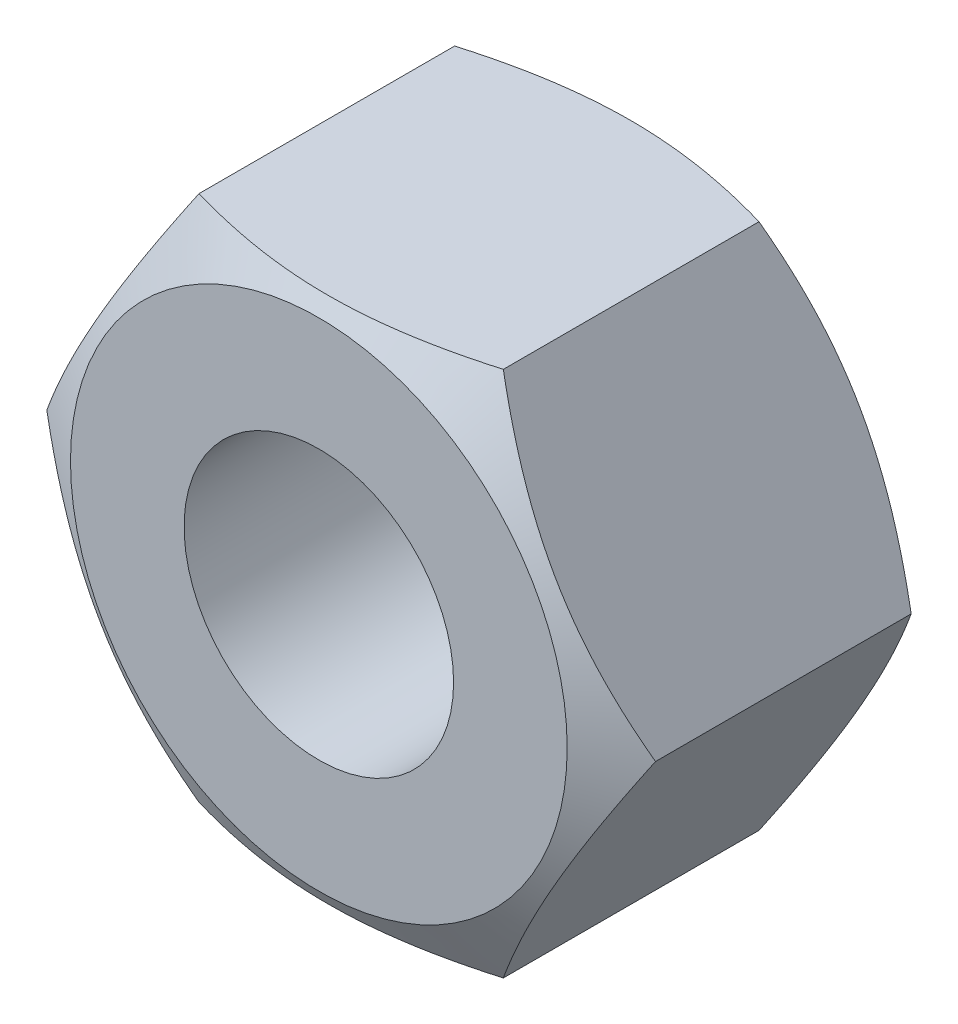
SolidWorks part; units mm, degrees
ref_plane "Front" through (0, 0, 0) normal (0, 0, 1) x (1, 0, 0)
ref_plane "Top" through (0, 0, 0) normal (0, 1, 0) x (1, 0, 0)
ref_plane "Right" through (0, 0, 0) normal (1, 0, 0) x (0, 0, -1)
sketch "Sketch1" plane through (0, 0, 0) normal (0, 0, 1) x (1, 0, 0)
  line L1 (3.7528, -6.5) -> (7.5056, 0)
  line L2 (7.5056, 0) -> (3.7528, 6.5)
  line L3 (3.7528, 6.5) -> (-3.7528, 6.5)
  line L4 (-3.7528, 6.5) -> (-7.5056, 0)
  line L5 (-7.5056, 0) -> (-3.7528, -6.5)
  line L6 (-3.7528, -6.5) -> (3.7528, -6.5)
  circle A0 centre (0, 0) radius 6.5 construction
  circle A1 centre (0, 0) radius 3.3235
  dimension "D" = 6.647
  dimension "s" = 13
extrude "BaseNut" add sketch "Sketch1" against normal blind 7.9
sketch "Sketch2" plane through (0, 0, 0) normal (0, 1, 0) x (1, 0, 0)
  line L0 (-7.5056, 7.9) -> (-6.125, 7.9)
  line L2 (-6.125, 7.9) -> (-7.5056, 7.1029)
  line L3 (-7.5056, 7.1029) -> (-7.5056, 7.9)
  line L4 (0, 3.3759) -> (0, -9.8171) construction
  line L6 (-9.7712, 3.95) -> (9.8853, 3.95) construction
  line L7 (-7.5056, 0.7971) -> (-7.5056, 0)
  line L8 (-6.125, 0) -> (-7.5056, 0.7971)
  line L9 (-7.5056, 0) -> (-6.125, 0)
  line L10 (-7.5056, 7.9) -> (-7.5056, 0) construction
  dimension "D1" = 30
  dimension "dw" = 12.25
  dimension "D2" = 3.95
revolve "Double-Chamfer" cut sketch "Sketch2" angle 360 about L4
sketch "Sketch4" plane through (0, 0, 0) normal (0, 1, 0) x (1, 0, 0)
  line L0 (3.9094, 7.9) -> (3.3235, 7.5617)
  line L1 (3.3235, 7.5617) -> (2.647, 7.5617)
  line L2 (2.647, 7.5617) -> (2.647, 8.2382)
  line L3 (2.647, 8.2382) -> (3.3235, 8.2382)
  line L4 (3.3235, 8.2382) -> (3.9094, 7.9)
  line L5 (0, 0) -> (0, 109.7681) construction
  dimension "D1" = 0.6765
  dimension "D2" = 6.647
revolve "Cut-Revolve10" [suppressed] cut sketch "Sketch4" angle 360 about L5
pattern_linear "LPattern10" [suppressed] count 11 spacing 0.8118 along (0, 0, -1)
equation "\"dw@Sketch2\" = \"s@Sketch1\"-0.75"
equation "\"D2@Sketch2\" = \"m@BaseNut\" / 2"
equation "\"D2@Sketch4\"=\"D@Sketch1\""
equation "\"D1@Sketch4\" =  (\"D@ThreadCosmetic1\" - \"D2@Sketch4\"  )  / 2"
equation "\"D3@LPattern10\" = \"D1@Sketch4\" * 1.2"
equation "\"D1@LPattern10\" = \"m@BaseNut\" / \"D3@LPattern10\" + 1"
